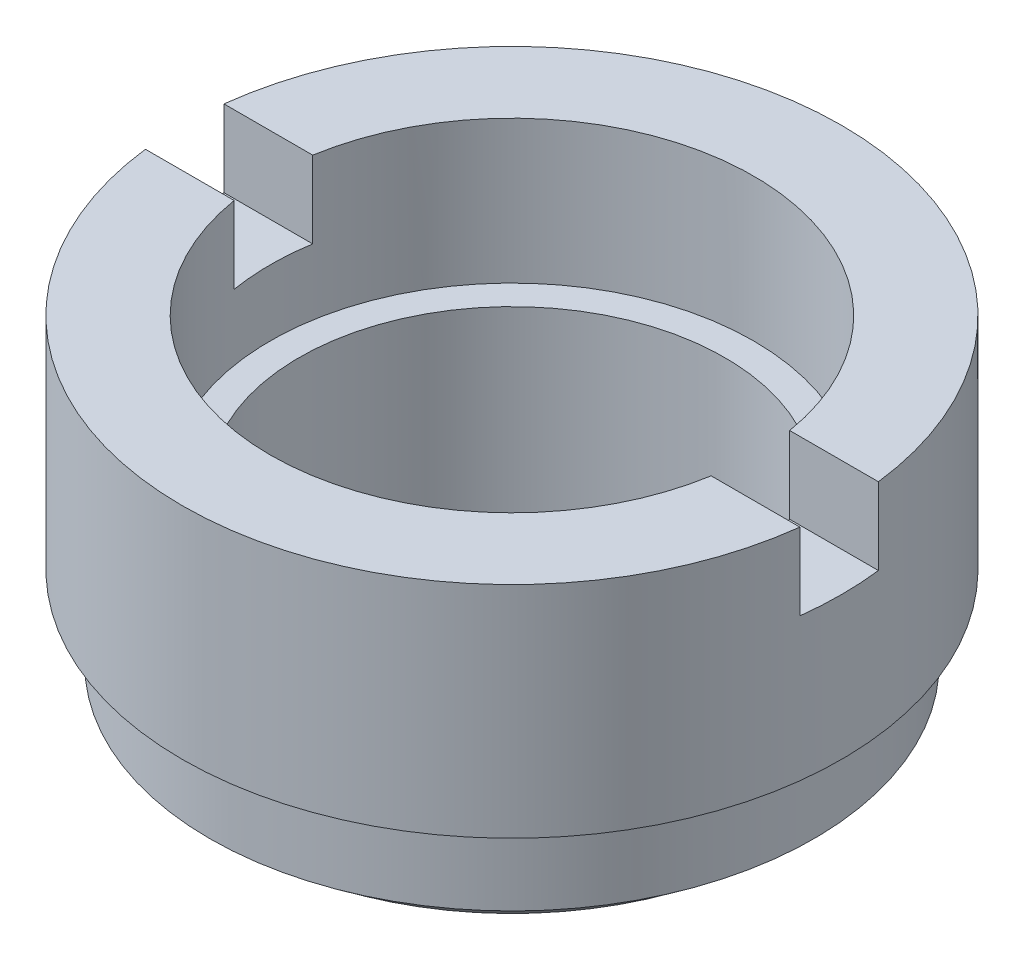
SolidWorks part; units mm, degrees
ref_plane "Plan1" through (0, 0, 0) normal (0, 0, 1) x (1, 0, 0)
ref_plane "Plan2" through (0, 0, 0) normal (0, 1, 0) x (1, 0, 0)
ref_plane "Plan3" through (0, 0, 0) normal (1, 0, 0) x (0, 0, -1)
sketch "Esquisse1" plane through (0, 0, 0) normal (0, 0, 1) x (1, 0, 0)
  line L0 (0, 50) -> (0, -20) construction
  line L1 (-3.875, 0) -> (-4.85, 0)
  line L2 (-4.85, 0) -> (-5.5, 0.5)
  line L3 (-5.5, 0.5) -> (-5.5, 2)
  line L4 (-5.5, 2) -> (-6, 2)
  line L5 (-6, 2) -> (-6, 6)
  line L6 (-6, 6) -> (-4.4, 6)
  line L7 (-4.4, 6) -> (-4.4, 3.4)
  line L8 (-4.4, 3.4) -> (-3.875, 3.4)
  line L9 (-3.875, 3.4) -> (-3.875, 0)
  dimension "D1" = 7.75
  dimension "D2" = 8.8
  dimension "D3" = 11
  dimension "D4" = 9.7
  dimension "D5" = 12
  dimension "D6" = 0.5
  dimension "D7" = 1.5
  dimension "D8" = 4
  dimension "D9" = 3.4
revolve "Base-Révolution" add sketch "Esquisse1" angle 360 about L0
sketch "Esquisse2" plane through (0, 6, 0) normal (0, 1, 0) x (-1, 0, 0)
  line L0 (-10, 0) -> (10, 0) construction
  line L1 (0, -10) -> (0, 10) construction
  line L2 (-7.5, -0.715) -> (7.5, -0.715)
  line L3 (-7.5, -0.715) -> (-7.5, 0.715)
  line L4 (-7.5, 0.715) -> (7.5, 0.715)
  line L5 (7.5, -0.715) -> (7.5, 0.715)
  dimension "D1" = 1.43
  dimension "D2" = 15
extrude "Enlèv. mat.-Extru.1" cut sketch "Esquisse2" against normal blind 1.4
